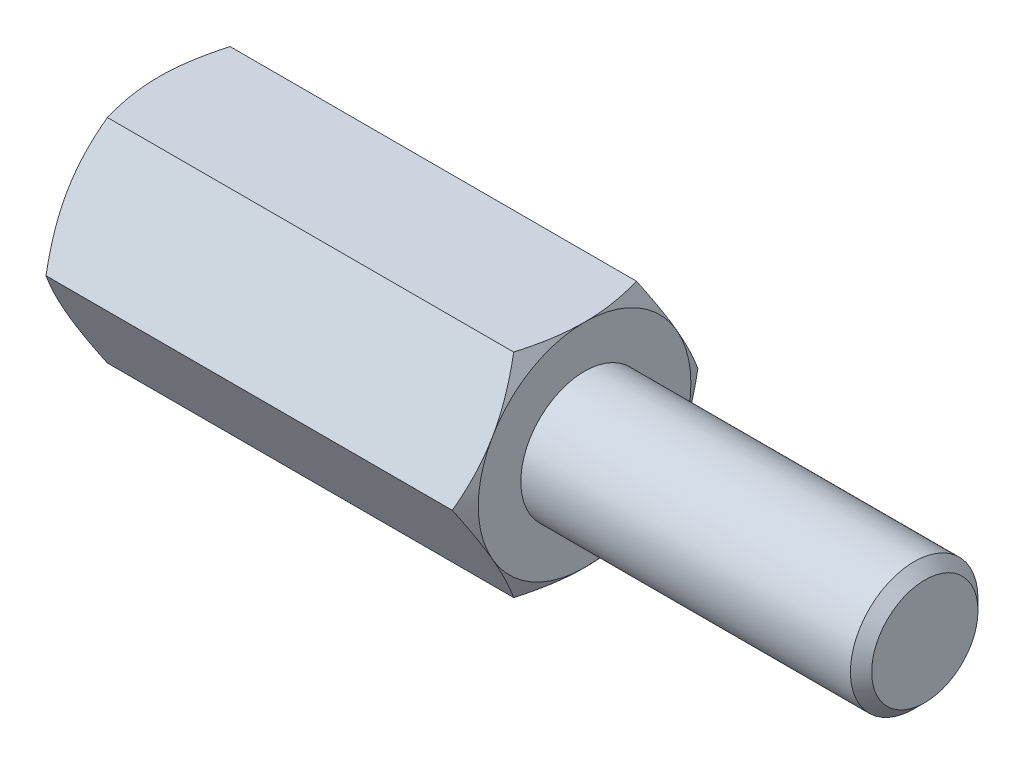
SolidWorks part; units mm, degrees
ref_plane "Front Plane" through (0, 0, 0) normal (0, 0, 1) x (1, 0, 0)
ref_plane "Top Plane" through (0, 0, 0) normal (0, 1, 0) x (1, 0, 0)
ref_plane "Right Plane" through (0, 0, 0) normal (1, 0, 0) x (0, 0, -1)
sketch "Sketch1" plane through (0, 0, 0) normal (1, 0, 0) x (0, 0, -1)
  line L1 (1.4434, 2.5) -> (-1.4434, 2.5)
  line L2 (-1.4434, 2.5) -> (-2.8868, 0)
  line L3 (-2.8868, 0) -> (-1.4434, -2.5)
  line L4 (-1.4434, -2.5) -> (1.4434, -2.5)
  line L5 (1.4434, -2.5) -> (2.8868, 0)
  line L6 (2.8868, 0) -> (1.4434, 2.5)
  circle A0 centre (0, 0) radius 2.5 construction
  dimension "D1" = 5
extrude "Extrude2" add sketch "Sketch1" along normal mid plane 10
sketch "Sketch2" plane through (0, 0, 0) normal (0, 0, 1) x (1, 0, 0)
  line L0 (-5, 2.5) -> (-3.5, 5.0981)
  line L1 (-5, 5.5) -> (-5, 2.5)
  line L3 (0, 0) -> (50000, 0) construction
  arc A0 (-3.5, 5.0981) -> (-5, 5.5) centre (-4.1962, 5.5) ccw
  dimension "D1" = 30
  dimension "D2" = 3
revolve "Cut-Revolve1" cut sketch "Sketch2" angle 360 about L3
mirror "Mirror1" about plane through (0, 0, 0) normal (1, 0, 0) of "Cut-Revolve1"
sketch "Sketch3" plane through (-5, 0, 0) normal (-1, 0, 0) x (0, 0, 1)
  circle A0 centre (0, 0) radius 1.25
  dimension "D1" = 2.5
extrude "Extrude3" cut sketch "Sketch3" against normal blind 5
sketch "Sketch4" plane through (0, 0, 0) normal (0, 0, 1) x (1, 0, 0)
  line L0 (0, 0) -> (0, 1.25)
  line L1 (4.7767, 0) -> (-4.7767, 0) construction
  line L2 (0, 1.25) -> (0.7217, 0)
  line L3 (0.7217, 0) -> (0, 0)
  line L4 (-5, 1.25) -> (-5, -1.25) construction
  point P4 (-5, 0)
  dimension "D1" = 30
  dimension "D2" = 1.25
  dimension "D3" = 5
revolve "Cut-Revolve2" cut sketch "Sketch4" angle 360 about L3
sketch "Sketch5" plane through (5, 0, 0) normal (1, 0, 0) x (0, 0, -1)
  circle A0 centre (0, 0) radius 1.5
  dimension "D1" = 3
extrude "Extrude4" add sketch "Sketch5" along normal blind 8
chamfer "Chamfer1" distance 0.25 angle 45 1 edges at (13, 0, -1.5)
equation "\"D2@Sketch4\" = \"D1@Sketch3\"/2"
